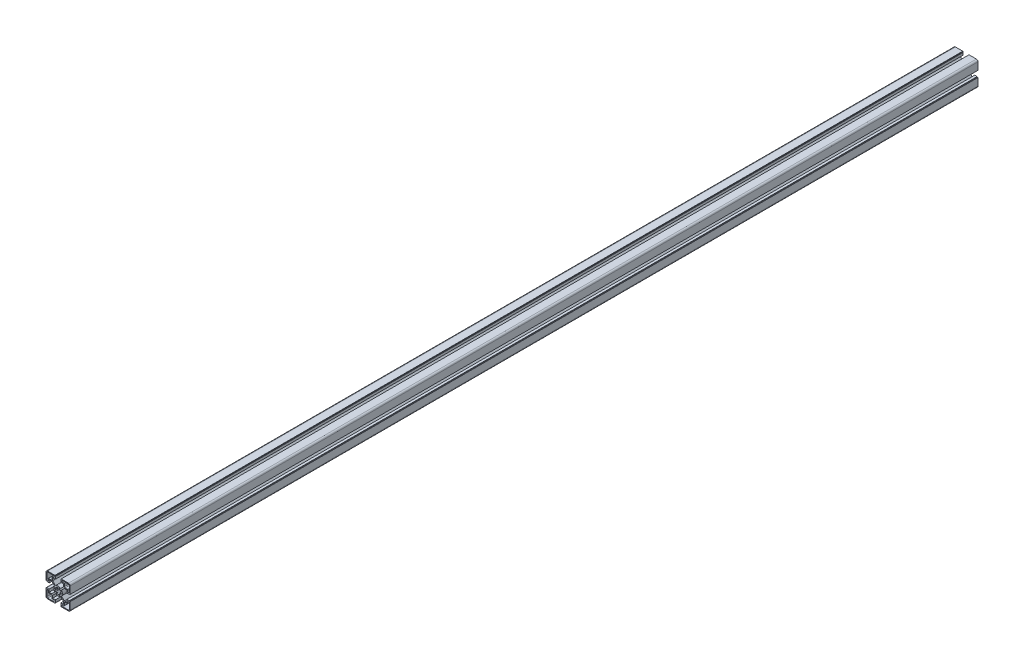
SolidWorks part; units mm, degrees
ref_plane "Front Plane" through (0, 0, 0) normal (0, 0, 1) x (1, 0, 0)
ref_plane "Top Plane" through (0, 0, 0) normal (0, 1, 0) x (1, 0, 0)
ref_plane "Right Plane" through (0, 0, 0) normal (1, 0, 0) x (0, 0, -1)
sketch "Sketch1" plane through (0, 0, 0) normal (0, 0, 1) x (1, 0, 0)
  line L2 (-19.5072, 22.5044) -> (-5.7912, 22.5044)
  line L3 (-5.7912, 22.5044) -> (-5.7912, 21.0058)
  line L4 (-5.7912, 21.0058) -> (-5.0038, 21.0058)
  line L6 (-5.0038, 21.0058) -> (-5.0038, 16.51)
  line L7 (-5.0038, 16.51) -> (-10.0457, 16.51)
  line L8 (-10.0457, 16.51) -> (-10.0457, 11.6801)
  line L9 (-10.0457, 11.6801) -> (-4.781, 6.4154)
  line L11 (-11.6801, 10.0457) -> (-6.4154, 4.781)
  line L12 (-16.51, 10.0457) -> (-11.6801, 10.0457)
  line L13 (-16.51, 5.0038) -> (-16.51, 10.0457)
  line L14 (-21.0058, 5.0038) -> (-16.51, 5.0038)
  line L15 (-21.0058, 5.7912) -> (-21.0058, 5.0038)
  line L16 (-22.5044, 5.7912) -> (-21.0058, 5.7912)
  line L17 (-22.5044, 19.5072) -> (-22.5044, 5.7912)
  line L18 (-18.0086, 11.5443) -> (-13.0429, 11.5443)
  line L19 (-18.0086, 11.5443) -> (-18.0086, 8.7884)
  line L20 (-11.5443, 18.0086) -> (-11.5443, 13.0429)
  line L21 (-21.0058, 19.5072) -> (-21.0058, 8.7884)
  line L23 (-11.5443, 18.0086) -> (-8.7884, 18.0086)
  line L24 (-19.5072, 21.0058) -> (-8.7884, 21.0058)
  line L25 (1.1893, 5.9789) -> (0.9762, 4.9077)
  line L26 (-1.1893, 5.9789) -> (-0.9762, 4.9077)
  line L27 (5.0686, 3.3868) -> (4.1605, 2.78)
  line L28 (3.3868, 5.0686) -> (2.78, 4.1605)
  line L29 (5.9789, -1.1893) -> (4.9077, -0.9762)
  line L30 (5.9789, 1.1893) -> (4.9077, 0.9762)
  line L31 (3.3868, -5.0686) -> (2.78, -4.1605)
  line L32 (5.0686, -3.3868) -> (4.1605, -2.78)
  line L33 (-1.1893, -5.9789) -> (-0.9762, -4.9077)
  line L34 (1.1893, -5.9789) -> (0.9762, -4.9077)
  line L35 (-5.0686, -3.3868) -> (-4.1605, -2.78)
  line L36 (-3.3868, -5.0686) -> (-2.78, -4.1605)
  line L37 (-5.9789, 1.1893) -> (-4.9077, 0.9762)
  line L38 (-5.9789, -1.1893) -> (-4.9077, -0.9762)
  line L39 (-3.3868, 5.0686) -> (-2.78, 4.1605)
  line L40 (-5.0686, 3.3868) -> (-4.1605, 2.78)
  line L41 (11.5443, 18.0086) -> (8.7884, 18.0086)
  line L42 (19.5072, 21.0058) -> (8.7884, 21.0058)
  line L43 (19.5072, 22.5044) -> (5.7912, 22.5044)
  line L44 (5.7912, 22.5044) -> (5.7912, 21.0058)
  line L45 (5.7912, 21.0058) -> (5.0038, 21.0058)
  line L46 (5.0038, 21.0058) -> (5.0038, 16.51)
  line L47 (5.0038, 16.51) -> (10.0457, 16.51)
  line L48 (10.0457, 16.51) -> (10.0457, 11.6801)
  line L49 (10.0457, 11.6801) -> (4.781, 6.4154)
  line L50 (11.6801, 10.0457) -> (6.4154, 4.781)
  line L51 (21.0058, 19.5072) -> (21.0058, 8.7884)
  line L52 (11.5443, 18.0086) -> (11.5443, 13.0429)
  line L53 (18.0086, 11.5443) -> (18.0086, 8.7884)
  line L54 (18.0086, 11.5443) -> (13.0429, 11.5443)
  line L55 (22.5044, 19.5072) -> (22.5044, 5.7912)
  line L56 (22.5044, 5.7912) -> (21.0058, 5.7912)
  line L57 (21.0058, 5.7912) -> (21.0058, 5.0038)
  line L58 (21.0058, 5.0038) -> (16.51, 5.0038)
  line L59 (16.51, 5.0038) -> (16.51, 10.0457)
  line L60 (16.51, 10.0457) -> (11.6801, 10.0457)
  line L61 (16.51, -10.0457) -> (11.6801, -10.0457)
  line L62 (16.51, -5.0038) -> (16.51, -10.0457)
  line L63 (21.0058, -5.0038) -> (16.51, -5.0038)
  line L64 (21.0058, -5.7912) -> (21.0058, -5.0038)
  line L65 (22.5044, -5.7912) -> (21.0058, -5.7912)
  line L66 (22.5044, -19.5072) -> (22.5044, -5.7912)
  line L67 (18.0086, -11.5443) -> (13.0429, -11.5443)
  line L68 (18.0086, -11.5443) -> (18.0086, -8.7884)
  line L69 (11.5443, -18.0086) -> (11.5443, -13.0429)
  line L70 (21.0058, -19.5072) -> (21.0058, -8.7884)
  line L71 (11.6801, -10.0457) -> (6.4154, -4.781)
  line L72 (10.0457, -11.6801) -> (4.781, -6.4154)
  line L73 (10.0457, -16.51) -> (10.0457, -11.6801)
  line L74 (5.0038, -16.51) -> (10.0457, -16.51)
  line L75 (5.0038, -21.0058) -> (5.0038, -16.51)
  line L76 (5.7912, -21.0058) -> (5.0038, -21.0058)
  line L77 (5.7912, -22.5044) -> (5.7912, -21.0058)
  line L78 (19.5072, -22.5044) -> (5.7912, -22.5044)
  line L79 (19.5072, -21.0058) -> (8.7884, -21.0058)
  line L80 (11.5443, -18.0086) -> (8.7884, -18.0086)
  line L81 (-11.5443, -18.0086) -> (-8.7884, -18.0086)
  line L82 (-19.5072, -21.0058) -> (-8.7884, -21.0058)
  line L83 (-19.5072, -22.5044) -> (-5.7912, -22.5044)
  line L84 (-5.7912, -22.5044) -> (-5.7912, -21.0058)
  line L85 (-5.7912, -21.0058) -> (-5.0038, -21.0058)
  line L86 (-5.0038, -21.0058) -> (-5.0038, -16.51)
  line L87 (-5.0038, -16.51) -> (-10.0457, -16.51)
  line L88 (-10.0457, -16.51) -> (-10.0457, -11.6801)
  line L89 (-10.0457, -11.6801) -> (-4.781, -6.4154)
  line L90 (-11.6801, -10.0457) -> (-6.4154, -4.781)
  line L91 (-21.0058, -19.5072) -> (-21.0058, -8.7884)
  line L92 (-11.5443, -18.0086) -> (-11.5443, -13.0429)
  line L93 (-18.0086, -11.5443) -> (-18.0086, -8.7884)
  line L94 (-18.0086, -11.5443) -> (-13.0429, -11.5443)
  line L95 (-22.5044, -19.5072) -> (-22.5044, -5.7912)
  line L96 (-22.5044, -5.7912) -> (-21.0058, -5.7912)
  line L97 (-21.0058, -5.7912) -> (-21.0058, -5.0038)
  line L98 (-21.0058, -5.0038) -> (-16.51, -5.0038)
  line L99 (-16.51, -5.0038) -> (-16.51, -10.0457)
  line L100 (-16.51, -10.0457) -> (-11.6801, -10.0457)
  arc A0 (-22.5044, 19.5072) -> (-19.5072, 22.5044) centre (-19.5072, 19.5072) cw
  arc A1 (-21.0058, 8.7884) -> (-18.0086, 8.7884) centre (-19.5072, 8.7884) ccw
  arc A2 (-21.0058, 19.5072) -> (-19.5072, 21.0058) centre (-19.5072, 19.5072) cw
  arc A3 (-8.7884, 21.0058) -> (-8.7884, 18.0086) centre (-8.7884, 19.5072) cw
  arc A4 (-11.5443, 13.0429) -> (-13.0429, 11.5443) centre (-13.0429, 13.0429) cw
  arc A5 (6.4154, -4.781) -> (6.4154, 4.781) centre (0, 0) ccw
  arc A6 (0.9762, 4.9077) -> (-0.9762, 4.9077) centre (0, 0) ccw
  arc A7 (-5.0686, 3.3868) -> (-5.9789, 1.1893) centre (0, 0) ccw
  arc A8 (4.1605, 2.78) -> (2.78, 4.1605) centre (0, 0) ccw
  arc A9 (4.9077, -0.9762) -> (4.9077, 0.9762) centre (0, 0) ccw
  arc A10 (2.78, -4.1605) -> (4.1605, -2.78) centre (0, 0) ccw
  arc A11 (-0.9762, -4.9077) -> (0.9762, -4.9077) centre (0, 0) ccw
  arc A12 (-4.1605, -2.78) -> (-2.78, -4.1605) centre (0, 0) ccw
  arc A13 (-4.9077, 0.9762) -> (-4.9077, -0.9762) centre (0, 0) ccw
  arc A14 (-2.78, 4.1605) -> (-4.1605, 2.78) centre (0, 0) ccw
  arc A15 (-5.9789, -1.1893) -> (-5.0686, -3.3868) centre (0, 0) ccw
  arc A16 (-3.3868, -5.0686) -> (-1.1893, -5.9789) centre (0, 0) ccw
  arc A17 (1.1893, -5.9789) -> (3.3868, -5.0686) centre (0, 0) ccw
  arc A18 (5.0686, -3.3868) -> (5.9789, -1.1893) centre (0, 0) ccw
  arc A19 (5.9789, 1.1893) -> (5.0686, 3.3868) centre (0, 0) ccw
  arc A20 (3.3868, 5.0686) -> (1.1893, 5.9789) centre (0, 0) ccw
  arc A21 (-1.1893, 5.9789) -> (-3.3868, 5.0686) centre (0, 0) ccw
  arc A22 (8.7884, 21.0058) -> (8.7884, 18.0086) centre (8.7884, 19.5072) ccw
  arc A23 (21.0058, 19.5072) -> (19.5072, 21.0058) centre (19.5072, 19.5072) ccw
  arc A24 (22.5044, 19.5072) -> (19.5072, 22.5044) centre (19.5072, 19.5072) ccw
  arc A25 (11.5443, 13.0429) -> (13.0429, 11.5443) centre (13.0429, 13.0429) ccw
  arc A26 (21.0058, 8.7884) -> (18.0086, 8.7884) centre (19.5072, 8.7884) cw
  arc A27 (21.0058, -8.7884) -> (18.0086, -8.7884) centre (19.5072, -8.7884) ccw
  arc A28 (11.5443, -13.0429) -> (13.0429, -11.5443) centre (13.0429, -13.0429) cw
  arc A29 (22.5044, -19.5072) -> (19.5072, -22.5044) centre (19.5072, -19.5072) cw
  arc A30 (21.0058, -19.5072) -> (19.5072, -21.0058) centre (19.5072, -19.5072) cw
  arc A31 (8.7884, -21.0058) -> (8.7884, -18.0086) centre (8.7884, -19.5072) cw
  arc A32 (-8.7884, -21.0058) -> (-8.7884, -18.0086) centre (-8.7884, -19.5072) ccw
  arc A33 (-21.0058, -19.5072) -> (-19.5072, -21.0058) centre (-19.5072, -19.5072) ccw
  arc A34 (-22.5044, -19.5072) -> (-19.5072, -22.5044) centre (-19.5072, -19.5072) ccw
  arc A35 (-11.5443, -13.0429) -> (-13.0429, -11.5443) centre (-13.0429, -13.0429) ccw
  arc A36 (-21.0058, -8.7884) -> (-18.0086, -8.7884) centre (-19.5072, -8.7884) cw
  arc A37 (4.781, 6.4154) -> (-4.781, 6.4154) centre (0, 0) ccw
  arc A38 (-4.781, -6.4154) -> (4.781, -6.4154) centre (0, 0) ccw
  arc A39 (-6.4154, 4.781) -> (-6.4154, -4.781) centre (0, 0) ccw
extrude "Boss-Extrude1" add sketch "Sketch1" against normal up to surface (1691.5384 mm away)
